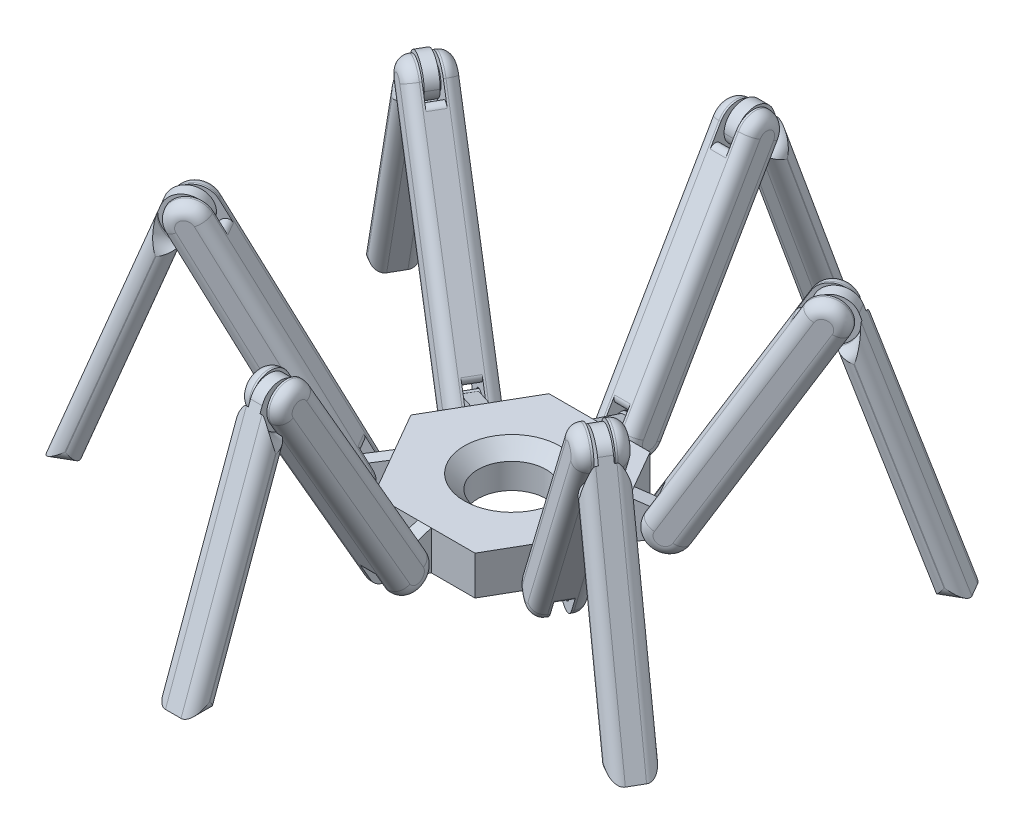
SolidWorks part; units mm, degrees
ref_plane "Front Plane" through (0, 0, 0) normal (0, 0, 1) x (1, 0, 0)
ref_plane "Top Plane" through (0, 0, 0) normal (0, 1, 0) x (1, 0, 0)
ref_plane "Right Plane" through (0, 0, 0) normal (1, 0, 0) x (0, 0, -1)
sketch "Sketch1" plane through (0, 0, 0) normal (0, 1, 0) x (1, 0, 0)
  line L0 (0, 0) -> (51.9615, 0) construction
  line L1 (51.9615, 0) -> (25.9808, 45)
  line L2 (25.9808, 45) -> (-25.9808, 45)
  line L3 (-25.9808, 45) -> (-51.9615, 0)
  line L4 (-51.9615, 0) -> (-25.9808, -45)
  line L5 (-25.9808, -45) -> (25.9808, -45)
  line L6 (25.9808, -45) -> (51.9615, 0)
  circle A0 centre (0, 0) radius 45 construction
  circle A1 centre (0, 0) radius 17.5
  dimension "D2" = 35
  dimension "D1" = 90
extrude "Boss-Extrude1" add sketch "Sketch1" along normal mid plane 20
chamfer "Chamfer1" distance 7 angle 45 1 edges at (0, 10, 17.5)
sketch "Sketch2" plane through (0, 0, 0) normal (1, 0, 0) x (0, 0, -1)
  line L0 (0, 0) -> (60, 0) construction
  circle A0 centre (60, 0) radius 5
  dimension "D1" = 10
  dimension "D2" = 60
extrude "Boss-Extrude2" add sketch "Sketch2" along normal mid plane 15 separate body
sketch "Sketch3" plane through (0, 0, 0) normal (1, 0, 0) x (0, 0, -1)
  line L0 (60, 0) -> (0, 0) construction
  line L1 (45, 10) -> (60, 5)
  line L3 (45, -10) -> (60, -5)
  line L4 (60, 5) -> (60, -5)
  line L5 (45, 10) -> (45, -10)
  circle A0 centre (60, 0) radius 5 construction
  point P0 (46.5091, 11.1575)
extrude "Boss-Extrude3" add sketch "Sketch3" along normal mid plane 7
pattern_circular "CirPattern3" count 6 over 360 about axis through (0, 0, 0) along (0, 1, 0)
combine bodies "Combine1" operation type add bodies to combine 108 107 104 106 105 109
sketch "Sketch4" plane through (0, 0, 0) normal (1, 0, 0) x (0, 0, -1)
  line L0 (60, 0) -> (120, 103.923) construction
  line L1 (51.3397, 5) -> (111.3397, 108.923)
  line L2 (68.6603, -5) -> (128.6603, 98.923)
  line L4 (60, 0) -> (90.9179, 0) construction
  line L5 (60, -10) -> (45, -10) construction
  arc A0 (51.3397, 5) -> (68.6603, -5) centre (60, 0) ccw
  arc A1 (128.6603, 98.923) -> (111.3397, 108.923) centre (120, 103.923) ccw
  circle A2 centre (60, 0) radius 5.5
  circle A3 centre (120, 103.923) radius 5.5
  point P3 (90, 51.9615)
  dimension "D4" = 11
  dimension "D5" = 11
  dimension "D2" = 60
  dimension "D3" = 120
extrude "Boss-Extrude4" add sketch "Sketch4" against normal blind 4 from offset 8 separate body
sketch "Sketch5" plane through (4, 0, 0) normal (-1, 0, 0) x (0, 0, 1)
  line L2 (-51.3397, 5) -> (-111.3397, 108.923)
  line L3 (-128.6603, 98.923) -> (-68.6603, -5)
  line L4 (-56.817, 14.4868) -> (-105.8625, 99.4362)
  line L5 (-123.183, 89.4362) -> (-74.1375, 4.4868)
  arc A0 (-68.8765, 4.6053) -> (-59.55, 9.9899) centre (-60, 0) cw
  arc A1 (-120.45, 93.9332) -> (-111.1235, 99.3178) centre (-120, 103.923) ccw
  arc A2 (-68.6603, -5) -> (-51.3397, 5) centre (-60, 0) ccw
  arc A3 (-111.3397, 108.923) -> (-128.6603, 98.923) centre (-120, 103.923) ccw
  arc A4 (-56.817, 14.4868) -> (-59.55, 9.9899) centre (-59.415, 12.9868) cw
  arc A5 (-120.45, 93.9332) -> (-123.183, 89.4362) centre (-120.585, 90.9362) ccw
  arc A6 (-111.1235, 99.3178) -> (-105.8625, 99.4362) centre (-108.4606, 97.9362) cw
  arc A7 (-68.8765, 4.6053) -> (-74.1375, 4.4868) centre (-71.5394, 5.9868) cw
  dimension "D2" = 3
  dimension "D3" = 3
  dimension "D1" = 0
extrude "Boss-Extrude5" add sketch "Sketch5" along normal up to surface (4 mm away)
sketch "Sketch6" plane through (8, 0, 0) normal (1, 0, 0) x (0, 0, -1)
  line L2 (68.6603, -5) -> (128.6603, 98.923)
  line L3 (111.3397, 108.923) -> (51.3397, 5)
  line L4 (68.6603, -5) -> (128.6603, 98.923)
  line L5 (111.3397, 108.923) -> (51.3397, 5)
  arc A2 (51.3397, 5) -> (68.6603, -5) centre (60, 0) ccw
  arc A3 (128.6603, 98.923) -> (111.3397, 108.923) centre (120, 103.923) ccw
  arc A4 (51.3397, 5) -> (68.6603, -5) centre (60, 0) ccw
  arc A5 (128.6603, 98.923) -> (111.3397, 108.923) centre (120, 103.923) ccw
  dimension "D1" = 0
extrude "Boss-Extrude6" add sketch "Sketch6" along normal blind 3
sketch "Sketch7" plane through (0, 0, 0) normal (-1, 0, 0) x (0, 0, 1)
  circle A0 centre (-120, 103.923) radius 5
  dimension "D1" = 10
extrude "Boss-Extrude7" add sketch "Sketch7" against normal offset from surface (7 mm away) 1 separate body
sketch "Sketch8" plane through (0, 0, 0) normal (-1, 0, 0) x (0, 0, 1)
  line L0 (-123.2081, 93.956) -> (-161.045, -10)
  line L1 (-161.045, -10) -> (-174.1064, -10)
  line L2 (-174.1064, -10) -> (-131.3969, 107.3432)
  line L3 (0, -10) -> (-161.045, -10) construction
  line L4 (-120, 103.923) -> (-112, 103.923) construction
  arc A0 (-120.2829, 95.9281) -> (-112, 103.923) centre (-120, 103.923) ccw
  circle A1 centre (-120, 103.923) radius 5 construction
  arc A2 (-120.2829, 95.9281) -> (-123.2081, 93.956) centre (-120.389, 92.9299) ccw
  arc A3 (-131.3969, 107.3432) -> (-112, 103.923) centre (-122, 103.923) cw
  arc A6 (-120.45, 93.9332) -> (-123.183, 89.4362) centre (-120.585, 90.9362) ccw construction
  point P11 (-152.6596, -10)
  dimension "D1" = 8
  dimension "D2" = 3
  dimension "D3" = 10
  dimension "D4" = 1
  dimension "D5" = 70
extrude "Boss-Extrude8" add sketch "Sketch8" against normal offset from surface (3 mm away) 1
sketch "Sketch9" plane through (3, 0, 0) normal (1, 0, 0) x (0, 0, -1)
  line L3 (123.2081, 93.956) -> (161.045, -10)
  line L4 (161.045, -10) -> (174.1064, -10)
  line L5 (174.1064, -10) -> (131.3969, 107.3432)
  line L6 (123.9026, 92.0479) -> (161.045, -10)
  line L7 (161.045, -10) -> (174.1064, -10)
  line L8 (174.1064, -10) -> (132.4933, 104.3309)
  arc A0 (132.4933, 104.3309) -> (123.9026, 92.0479) centre (120, 103.923) cw
  arc A2 (128.6603, 98.923) -> (111.3397, 108.923) centre (120, 103.923) ccw construction
  arc A3 (123.2081, 93.956) -> (120.2829, 95.9281) centre (120.389, 92.9299) ccw
  arc A4 (131.3969, 107.3432) -> (112, 103.923) centre (122, 103.923) ccw
  arc A5 (112, 103.923) -> (120.2829, 95.9281) centre (120, 103.923) ccw
  point P14 (122.6355, 86.6025)
  dimension "D2" = 12.5
  dimension "D1" = 0
extrude "Boss-Extrude9" add sketch "Sketch9" along normal blind 7
fillet "Fillet1" radius 6 4 edges at (11, 56.9615, -81.3397) (11, 112.5833, -125) (11, 46.9615, -98.6603) (11, -8.6603, -55)
fillet "Fillet2" radius 6 4 edges at (10, 47.1654, -153.2999) (10, -10, -167.5757) (10, 41.0239, -142.4738) (10, 96.7589, -130.2433)
mirror "Mirror1" about plane through (0, 0, 0) normal (1, 0, 0)
pattern_circular "CirPattern4" count 6 over 360 about axis through (0, 0, 0) along (0, 1, 0)
